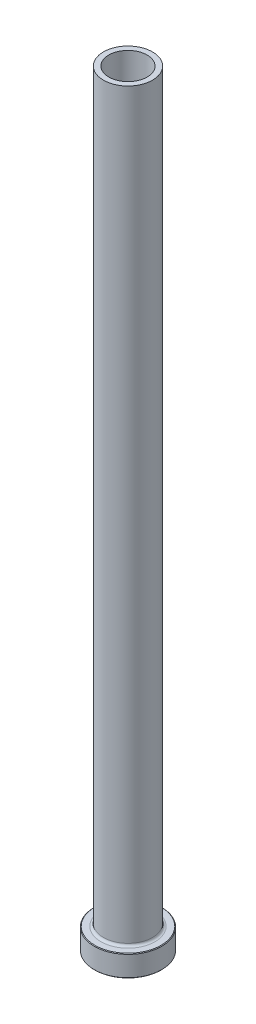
SolidWorks part; units mm, degrees
ref_plane "Front Plane" through (0, 0, 0) normal (0, 0, 1) x (1, 0, 0)
ref_plane "Top Plane" through (0, 0, 0) normal (0, 1, 0) x (1, 0, 0)
ref_plane "Right Plane" through (0, 0, 0) normal (1, 0, 0) x (0, 0, -1)
sketch "Sketch1" plane through (0, 0, 0) normal (0, 0, 1) x (1, 0, 0)
  line L0 (-6.25, 250) -> (-8, 250)
  line L1 (-8, 250) -> (-8, 7)
  line L2 (-8, 7) -> (-11, 7)
  line L3 (-11, 7) -> (-11, 0)
  line L4 (12.1, 0) -> (-12.1, 0) construction
  line L5 (-11, 0) -> (-6.5, 0)
  line L6 (-6.25, 195) -> (-6.25, 250)
  line L7 (0, 92.1877) -> (0, -15.5353) construction
  line L8 (0, -12.1) -> (0, 12.1) construction
  line L9 (-6.25, 195) -> (-6.5, 183)
  line L10 (-6.5, 183) -> (-6.5, 0)
  dimension "D1" = 0.25
  dimension "ID" = 12.5
  dimension "OD" = 16
  dimension "L" = 250
  dimension "H" = 22
  dimension "T" = 7
  dimension "N" = 55
  dimension "D2" = 12
revolve "Revolve1" add sketch "Sketch1" angle 360 about L7
fillet "Fillet1" radius 0.8 1 edges at (0, 7, 8)
chamfer "Chamfer1" distance 0.2 angle 45 2 edges at (0, 7, 11) (0, 0, 11)
chamfer "Chamfer3" distance 0.5 angle 45 1 edges at (0, 0, 6.5)
